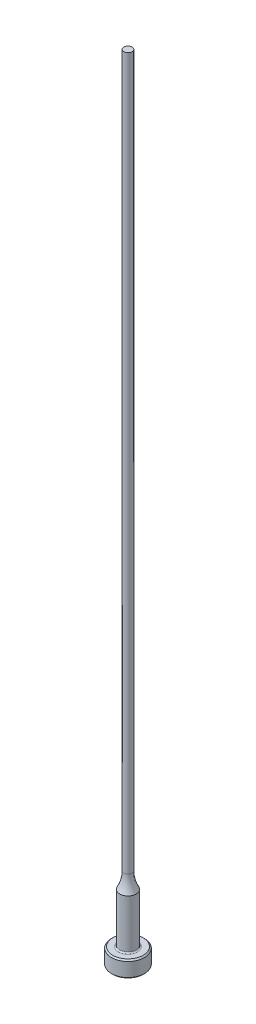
SolidWorks part; units mm, degrees
ref_plane "Front Plane" through (0, 0, 0) normal (0, 0, 1) x (1, 0, 0)
ref_plane "Top Plane" through (0, 0, 0) normal (0, 1, 0) x (1, 0, 0)
ref_plane "Right Plane" through (0, 0, 0) normal (1, 0, 0) x (0, 0, -1)
sketch "Sketch1" plane through (0, 0, 0) normal (0, 0, 1) x (1, 0, 0)
  line L0 (0, 259.9588) -> (0, -15.1925) construction
  line L1 (0, 0) -> (-3.175, 0)
  line L2 (-3.175, 0) -> (-3.175, 3.175)
  line L3 (-3.175, 3.175) -> (-1.5875, 3.175)
  line L4 (-0.7937, 15.7742) -> (-0.7937, 152.4)
  line L5 (-0.7937, 152.4) -> (0, 152.4)
  line L6 (0, 152.4) -> (0, 0)
  line L7 (-1.5875, 3.175) -> (-1.5875, 12.7)
  arc A0 (-1.5875, 12.7) -> (-0.7937, 15.7742) centre (-7.1437, 15.7742) ccw
  point P13 (-1.5875, 0)
  dimension "D1" = 6.35
  dimension "L" = 152.4
  dimension "D2" = 3.175
  dimension "H" = 6.35
  dimension "T" = 3.175
  dimension "D" = 1.5875
  dimension "S" = 12.7
revolve "Revolve1" add sketch "Sketch1" angle 360 about L0
chamfer "Chamfer1" distance 0.254 angle 45 2 edges at (0, 3.175, 3.175) (0, 0, 3.175)
fillet "Fillet1" radius 0.254 1 edges at (0, 3.175, 1.5875)
